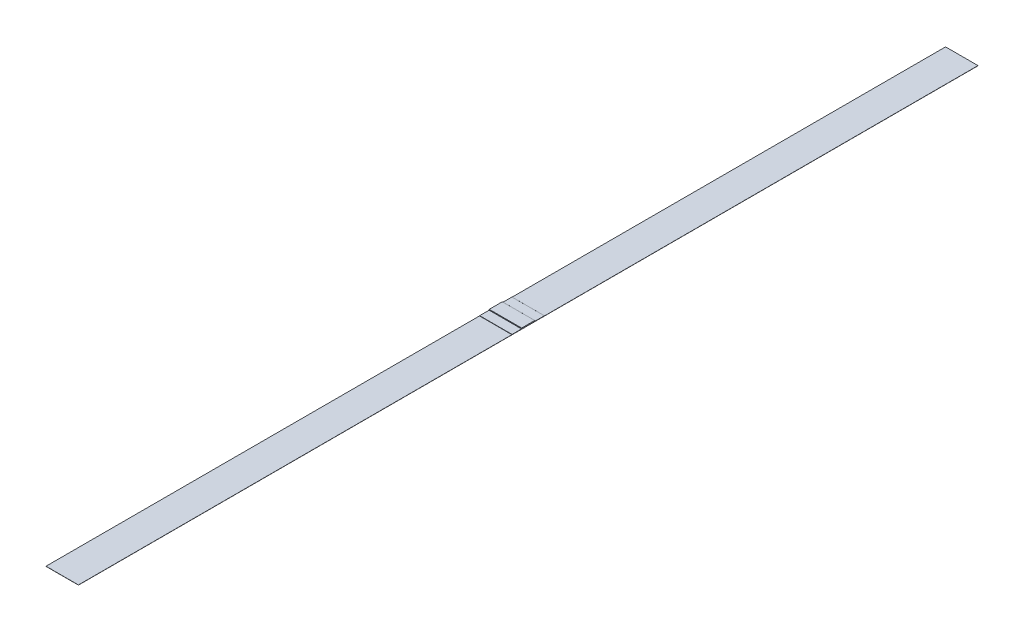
SolidWorks part; units mm, degrees
ref_plane "Front Plane" through (0, 0, 0) normal (0, 0, 1) x (1, 0, 0)
ref_plane "Top Plane" through (0, 0, 0) normal (0, 1, 0) x (1, 0, 0)
ref_plane "Right Plane" through (0, 0, 0) normal (1, 0, 0) x (0, 0, -1)
sketch "Sketch1" plane through (0, 0, 0) normal (0, 1, 0) x (1, 0, 0)
  line L5 (19.05, -76.2) -> (66.675, -76.2)
  line L6 (19.05, -76.2) -> (19.05, 1244.6)
  line L7 (19.05, 1244.6) -> (66.675, 1244.6)
  line L8 (66.675, -76.2) -> (66.675, 1244.6)
  dimension "D1" = 1320.8
extrude "Boss-Extrude1" add sketch "Sketch1" along normal blind 0.254
sketch "Sketch2" plane through (0, 0.254, 0) normal (0, 1, 0) x (1, 0, 0)
  line L1 (19.05, -76.2) -> (66.675, -76.2) construction
  line L5 (19.05, 560.3875) -> (66.675, 560.3875)
  line L6 (19.05, 560.3875) -> (19.05, 608.0125)
  line L7 (19.05, 608.0125) -> (66.675, 608.0125)
  line L8 (66.675, 560.3875) -> (66.675, 608.0125)
  dimension "D1" = 47.625
  dimension "D2" = 636.5875
extrude "Boss-Extrude2" add sketch "Sketch2" along normal blind 0.254 contours L5 L8 L7 L6
fillet "Fillet1" radius 0.127 8 edges at (42.8625, 0.508, -608.0125) (66.675, 0.381, -608.0125) (19.05, 0.381, -608.0125) (42.8625, 0.254, -560.3875) (19.05, 0.381, -560.3875) (66.675, 0.381, -560.3875) (42.8625, 0.508, -560.3875) (42.8625, 0.254, -608.0125)
sketch "Sketch3" plane through (0, 0.508, 0) normal (0, 1, 0) x (1, 0, 0)
  line L0 (19.05, 560.5145) -> (66.675, 560.5145) construction
  line L1 (19.05, 574.4845) -> (66.675, 574.4845)
  line L2 (19.05, 574.4845) -> (19.05, 593.9155)
  line L3 (19.05, 593.9155) -> (66.675, 593.9155)
  line L4 (66.675, 574.4845) -> (66.675, 593.9155)
  line L5 (66.675, 607.8855) -> (19.05, 607.8855) construction
  dimension "D1" = 13.97
  dimension "D2" = 13.97
extrude "Boss-Extrude3" add sketch "Sketch3" along normal blind 1.016
fillet "Fillet2" radius 0.127 4 edges at (42.8625, 0.508, -593.9155) (42.8625, 1.524, -593.9155) (42.8625, 1.524, -574.4845) (42.8625, 0.508, -574.4845)
